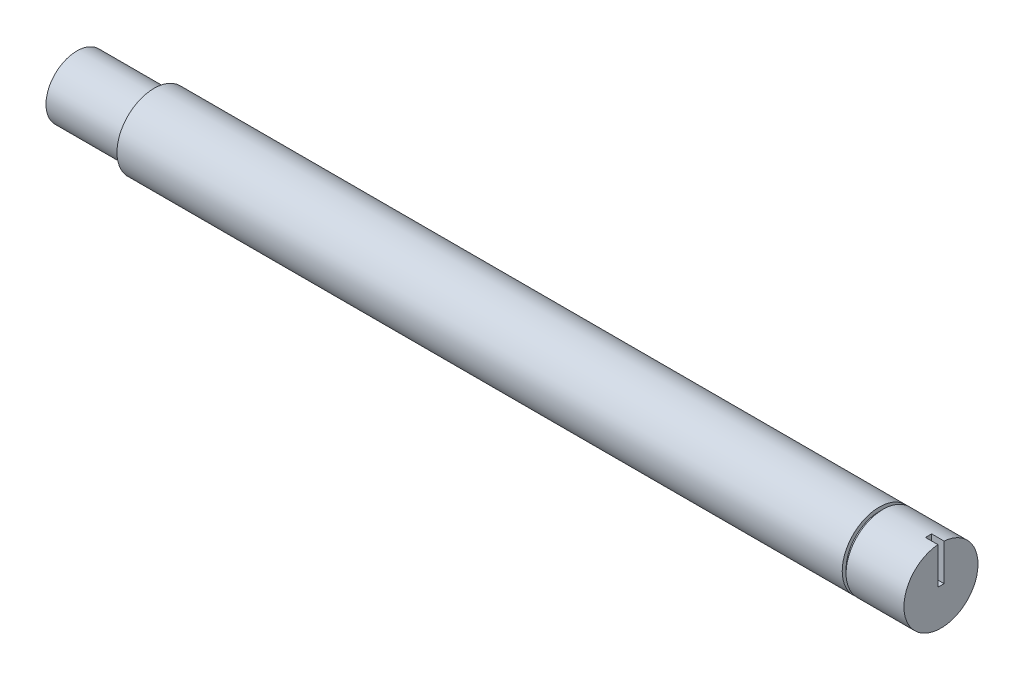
SolidWorks part; units mm, degrees
ref_plane "Front" through (0, 0, 0) normal (0, 0, 1) x (1, 0, 0)
ref_plane "Top" through (0, 0, 0) normal (0, 1, 0) x (1, 0, 0)
ref_plane "Right" through (0, 0, 0) normal (1, 0, 0) x (0, 0, -1)
sketch "Sketch1" plane through (0, 0, 0) normal (1, 0, 0) x (0, 0, -1)
  circle A0 centre (0, 0) radius 7.62
  dimension "D1" = 15.24
extrude "Base-Extrude" add sketch "Sketch1" along normal blind 177.8
ref_plane "Plane4" through (165.8937, 0, 0) normal (1, 0, 0) x (0, 0, -1)
sketch "Sketch2" plane through (165.8937, 0, 0) normal (1, 0, 0) x (0, 0, -1)
  circle A1 centre (0, 0) radius 6.8262
  circle A2 centre (0, 0) radius 6.8262
  circle A3 centre (0, 0) radius 7.62
  circle A4 centre (0, 0) radius 7.62
  dimension "D1" = 0.7937
  dimension "D2" = 0
extrude "Cut-Extrude1" cut sketch "Sketch2" against normal blind 0.7937
sketch "Sketch3" plane through (0, 0, 0) normal (-1, 0, 0) x (0, 0, 1)
  circle A0 centre (0, 0) radius 7.62 construction
  circle A1 centre (0, 0) radius 6.35
  circle A2 centre (0, 0) radius 6.35
  circle A3 centre (0, 0) radius 7.62
  dimension "D1" = 1.27
extrude "Cut-Extrude2" cut sketch "Sketch3" against normal blind 15.875
sketch "Sketch4" plane through (177.8, 0, 0) normal (1, 0, 0) x (0, 0, -1)
  line L0 (0, 0) -> (0, 10.6333) construction
  line L1 (-0.635, 0) -> (0.635, 0)
  line L2 (-0.635, 0) -> (-0.635, 7.5935)
  line L4 (0.635, 0) -> (0.635, 7.5935)
  circle A0 centre (0, 0) radius 7.62 construction
  arc A1 (0.635, 7.5935) -> (-0.635, 7.5935) centre (0, 0) ccw
  dimension "D1" = 1.27
extrude "Cut-Extrude3" cut sketch "Sketch4" against normal blind 2.54
